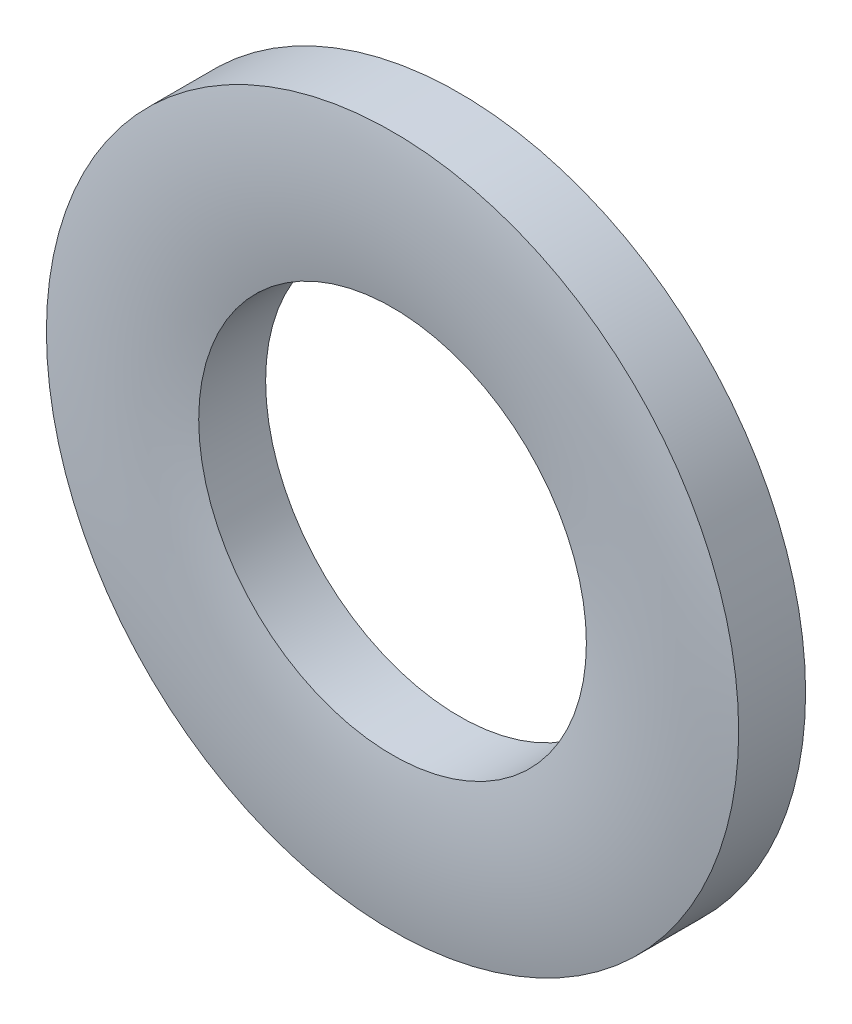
SolidWorks part; units mm, degrees
ref_plane "Front Plane" through (0, 0, 0) normal (0, 0, 1) x (1, 0, 0)
ref_plane "Top Plane" through (0, 0, 0) normal (0, 1, 0) x (1, 0, 0)
ref_plane "Right Plane" through (0, 0, 0) normal (1, 0, 0) x (0, 0, -1)
sketch "Sketch1" plane through (0, 0, 0) normal (0, 0, 1) x (1, 0, 0)
  circle A0 centre (0, 0) radius 4.2
  circle A1 centre (0, 0) radius 7.5
  dimension "ID" = 8.4
  dimension "OD" = 15
sketch "Sketch2" plane through (0, 0, 0) normal (1, 0, 0) x (0, 0, -1)
  line L0 (-0.8, 7.5) -> (0.8, 7.5) construction
  line L1 (-0.8, 0) -> (0.8, 0) construction
  point P2 (0, 7.5)
sketch "Sketch3" plane through (0, 0, 0) normal (1, 0, 0) x (0, 0, -1)
  line L0 (0.8, 7.5) -> (-0.6501, 7.5)
  line L1 (0.8, 4.2) -> (-0.6501, 4.2)
  line L2 (0.8, 4.2) -> (0.8, 7.5)
  line L3 (-0.8, 7.5) -> (-0.8, 4.2) construction
  arc A0 (-0.6501, 4.2) -> (-0.6501, 7.5) centre (8.3548, 5.85) cw
  point P9 (0, 4.2)
revolve "Revolve1" add sketch "Sketch3" angle 360 about L1
equation "\"D1@Sketch3\"=\"Thickness Range@Sketch2\"*.0937"
